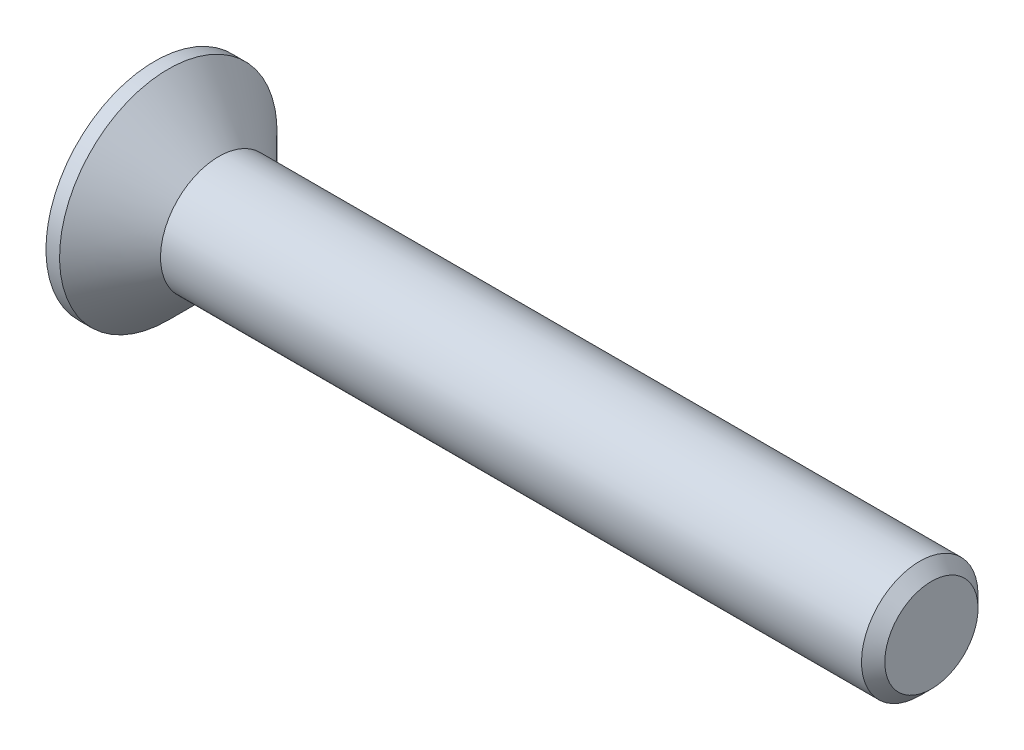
SolidWorks part; units mm, degrees
ref_plane "Front Plane" through (0, 0, 0) normal (0, 0, 1) x (1, 0, 0)
ref_plane "Top Plane" through (0, 0, 0) normal (0, 1, 0) x (1, 0, 0)
ref_plane "Right Plane" through (0, 0, 0) normal (1, 0, 0) x (0, 0, -1)
sketch "Sketch1" plane through (0, 0, 0) normal (0, 0, 1) x (1, 0, 0)
  line L1 (-1.65, 2.8) -> (-1.65, 0)
  line L2 (-1.65, 0) -> (18.35, 0)
  line L3 (18.35, 0) -> (18.35, 1.5)
  line L4 (18.35, 1.5) -> (0, 1.5)
  line L5 (-1.65, 2.8) -> (-1.3, 2.8)
  line L6 (-1.3, 2.8) -> (0, 1.5)
  dimension "D1" = 1.5
  dimension "D2" = 45
  dimension "D3" = 1.65
  dimension "D4" = 20
  dimension "D5" = 2.8
revolve "Revolve1" add sketch "Sketch1" angle 360 about L2
chamfer "Chamfer1" distance 0.3 angle 45 1 edges at (18.35, -1.5, 0)
sketch "Sketch2" plane through (-1.65, 0, 0) normal (-1, 0, 0) x (0, 0, 1)
  line L0 (-0.365, 1.45) -> (0.365, 1.45)
  line L1 (0.365, 1.45) -> (0.365, 0.365)
  line L2 (0.365, 0.365) -> (1.45, 0.365)
  line L3 (1.45, 0.365) -> (1.45, -0.365)
  line L4 (1.45, -0.365) -> (0.365, -0.365)
  line L5 (0.365, -0.365) -> (0.365, -1.45)
  line L6 (0.365, -1.45) -> (-0.365, -1.45)
  line L7 (-0.365, -1.45) -> (-0.365, -0.365)
  line L8 (-0.365, -0.365) -> (-1.45, -0.365)
  line L9 (-1.45, -0.365) -> (-1.45, 0.365)
  line L10 (-1.45, 0.365) -> (-0.365, 0.365)
  line L11 (-0.365, 0.365) -> (-0.365, 1.45)
  point P2 (0, 1.45)
  point P14 (0, -1.45)
  point P15 (1.45, 0)
  point P16 (-1.45, 0)
  dimension "D1" = 2.9
  dimension "D2" = 0.73
extrude "Cut-Extrude1" cut sketch "Sketch2" against normal blind 1.25
